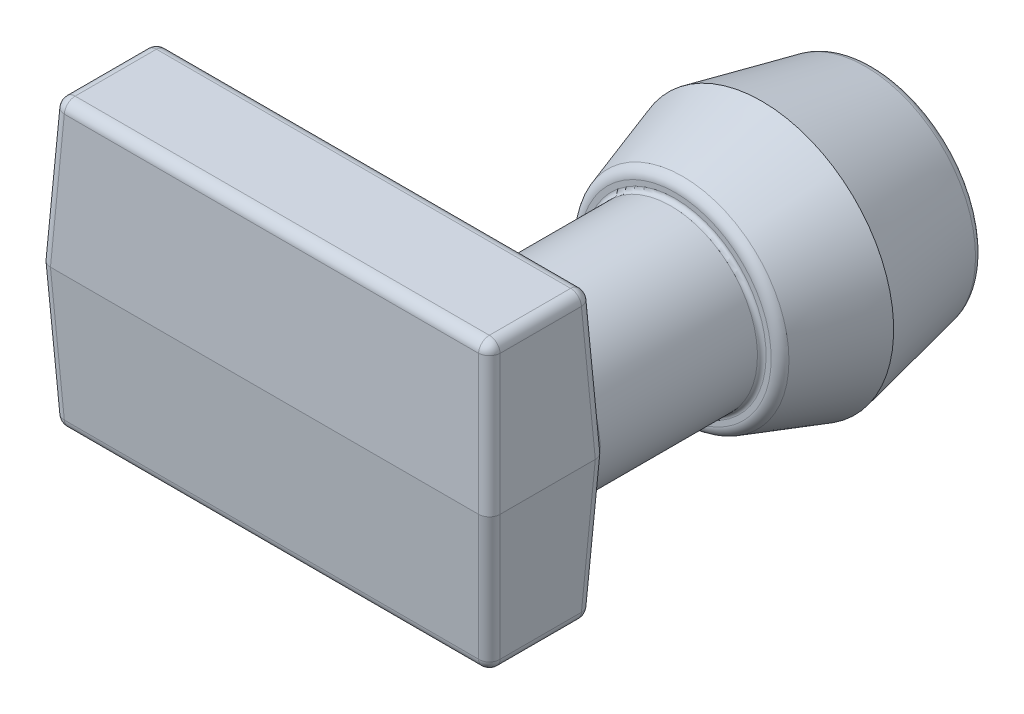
SolidWorks part; units mm, degrees
ref_plane "Plan1" through (0, 0, 0) normal (0, 0, 1) x (1, 0, 0)
ref_plane "Plan2" through (0, 0, 0) normal (0, 1, 0) x (1, 0, 0)
ref_plane "Plan3" through (0, 0, 0) normal (1, 0, 0) x (0, 0, -1)
ref_plane "Plan4" through (0, 0, 0) normal (0, -1, 0) x (1, 0, 0)
sketch "Esquisse4" plane through (0, 0, 0) normal (0, -1, 0) x (1, 0, 0)
  line L0 (-3, -26) -> (-3, 49) construction
  line L1 (-3, 11.445) -> (-3, -26.5408) construction
  line L2 (19, 37) -> (-85, 37)
  line L3 (-85, 37) -> (-85, 10)
  line L4 (-85, 10) -> (19, 10)
  line L5 (19, 10) -> (19, 37)
  line L6 (42.5, 0) -> (0, 0) construction
  dimension "D1" = 104
  dimension "D2" = 27
  dimension "D3" = 10
  dimension "D4" = 22
extrude "Base-Extrusion" add sketch "Esquisse4" along normal mid plane 66 draft 3
fillet "Congé4" radius 2.5
sketch "Esquisse5" plane through (0, 0, 0) normal (0, -1, 0) x (1, 0, 0)
  line L0 (17, 35) -> (17, -28)
  line L1 (-3, 10) -> (-3, -85) construction
  line L2 (-3, 11.445) -> (-3, -26.5408) construction
  line L3 (16.5034, 37) -> (-82.5034, 37) construction
  line L4 (-3, -74) -> (22, -74)
  line L5 (22, -74) -> (27.5, -48)
  line L6 (27.5, -48) -> (21, -28)
  line L7 (21, -28) -> (17, -28)
  line L8 (17, 35) -> (-3, 35)
  line L9 (-3, 35) -> (-3, -74)
  dimension "D1" = 20
  dimension "D2" = 65
  dimension "D3" = 111
  dimension "D4" = 30.5
  dimension "D5" = 24
  dimension "D6" = 26
revolve "Boss.-Révol.1" add sketch "Esquisse5" angle 360 about L1
fillet "Congé1" radius 2.5
fillet "Congé5" radius 1
fillet "Congé6" radius 2.5
ref_plane "Plan5" through (-94, 0, 0) normal (1, 0, 0) x (0, 0, -1)
sketch "Esquisse6" plane through (-94, 0, 0) normal (1, 0, 0) x (0, 0, -1)
  line L0 (-10, 0) -> (85, 0) construction
  circle A0 centre (-20, -12) radius 5
  dimension "D1" = 10
  dimension "D2" = 12
  dimension "D3" = 20
extrude "Boss.-Extru.1" add sketch "Esquisse6" along normal up to next
chamfer "Chanfrein1" distance 1 angle 45
